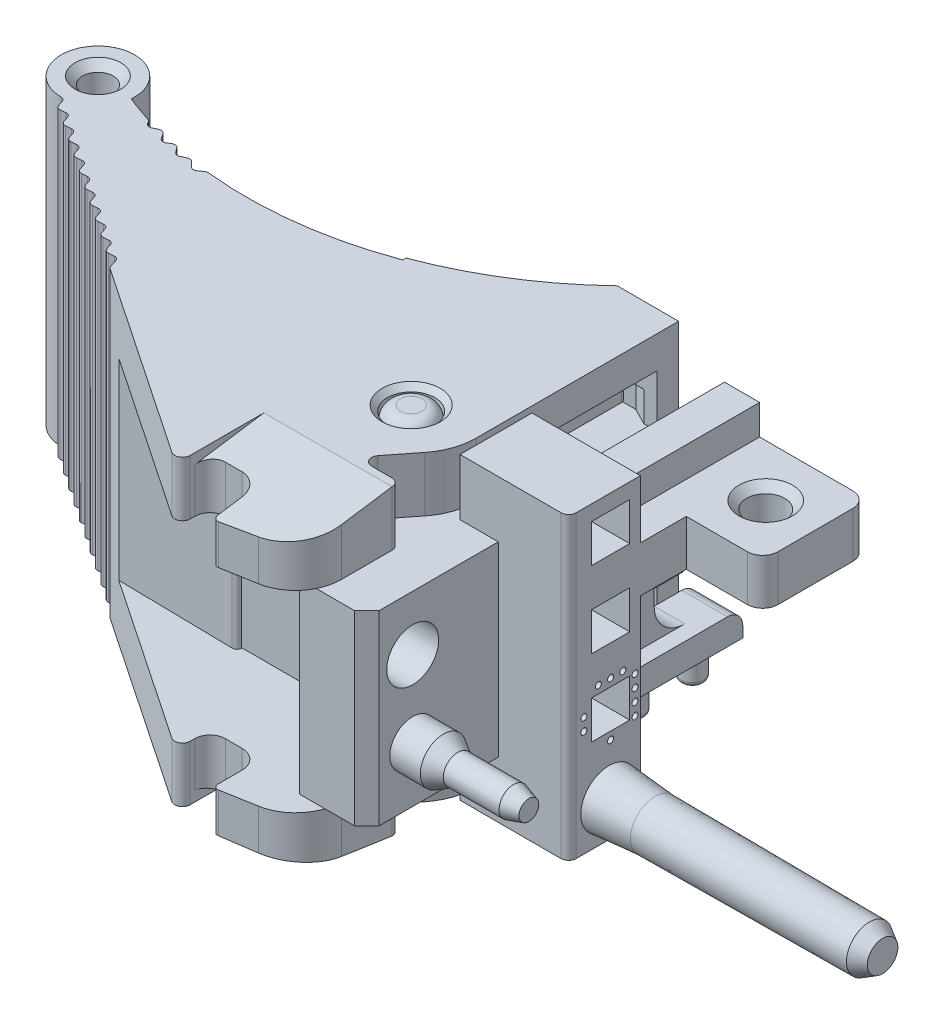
SolidWorks part; units mm, degrees
other "<T02暗红按钮助拔器>-<输入1>"
other "<T02暗红按钮助拔器>-<输入2>"
other "<T02暗红按钮助拔器>-<输入3>"
other "<T02暗红按钮助拔器>-<输入4>"
ref_plane "前视基准面" through (0, 0, 0) normal (0, 0, 1) x (1, 0, 0)
ref_plane "上视基准面" through (0, 0, 0) normal (0, 1, 0) x (1, 0, 0)
ref_plane "右视基准面" through (0, 0, 0) normal (1, 0, 0) x (0, 0, -1)
mirrored part "T02暗红按钮助拔器镜向"
